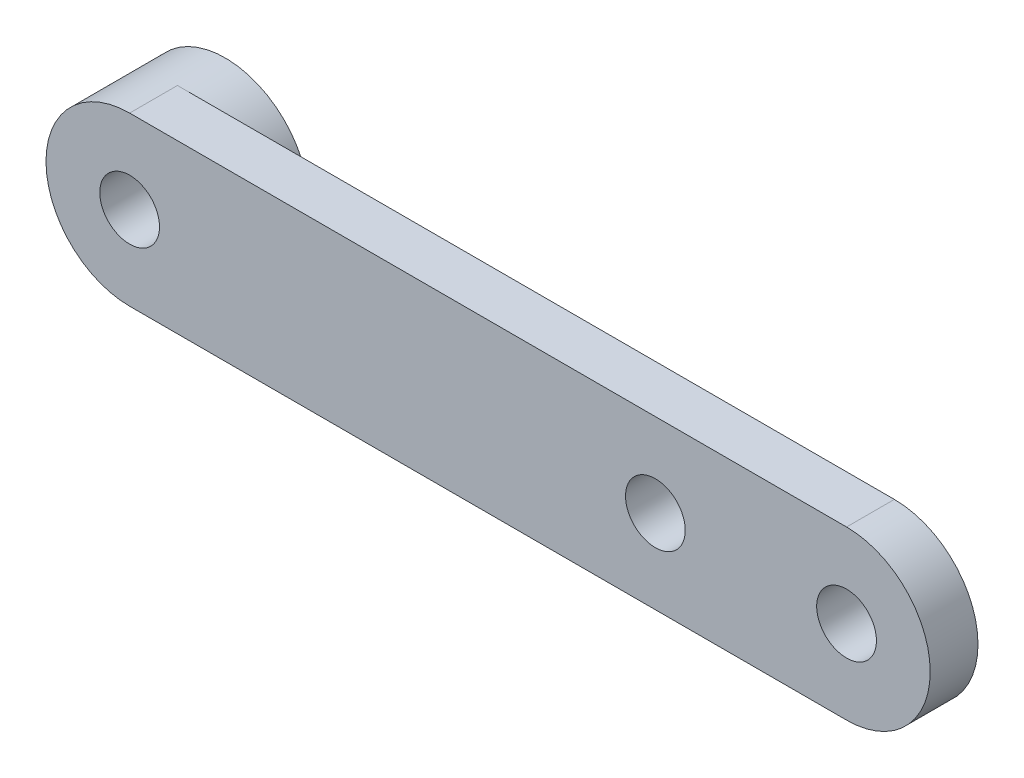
SolidWorks part; units mm, degrees
ref_plane "Front Plane" through (0, 0, 0) normal (0, 0, 1) x (1, 0, 0)
ref_plane "Top Plane" through (0, 0, 0) normal (0, 1, 0) x (1, 0, 0)
ref_plane "Right Plane" through (0, 0, 0) normal (1, 0, 0) x (0, 0, -1)
sketch "Sketch1" plane through (0, 0, 0) normal (0, 0, 1) x (1, 0, 0)
  line L0 (-31.75, -3.81) -> (-69.85, -3.81) construction
  line L1 (-31.75, -8.255) -> (-69.85, -8.255)
  line L2 (-31.75, 0.635) -> (-69.85, 0.635)
  arc A0 (-31.75, -8.255) -> (-31.75, 0.635) centre (-31.75, -3.81) ccw
  arc A1 (-69.85, 0.635) -> (-69.85, -8.255) centre (-69.85, -3.81) ccw
  point P3 (-50.8, -3.81)
extrude "Extrude1" add sketch "Sketch1" along normal blind 2.54
sketch "Sketch2" plane through (0, 0, 0) normal (0, 0, 1) x (1, 0, 0)
  line L0 (-31.75, -3.81) -> (-69.85, -3.81) construction
  circle A0 centre (-31.75, -3.81) radius 1.5875
  circle A1 centre (-41.91, -3.81) radius 1.5875
  circle A2 centre (-69.85, -3.81) radius 1.5875
  circle A8 centre (-41.91, -3.81) radius 1.5875 construction
  dimension "D2" = 3.175
  dimension "D3" = 3.175
  dimension "D4" = 3.175
extrude "Cut-Extrude3" cut sketch "Sketch2" along normal through all
sketch "Sketch3" plane through (0, 0, 0) normal (0, 0, -1) x (-1, 0, 0)
  circle A0 centre (69.85, -3.81) radius 4.445
  circle A1 centre (69.85, -3.81) radius 1.5875
extrude "Extrude2" add sketch "Sketch3" along normal blind 2.54
